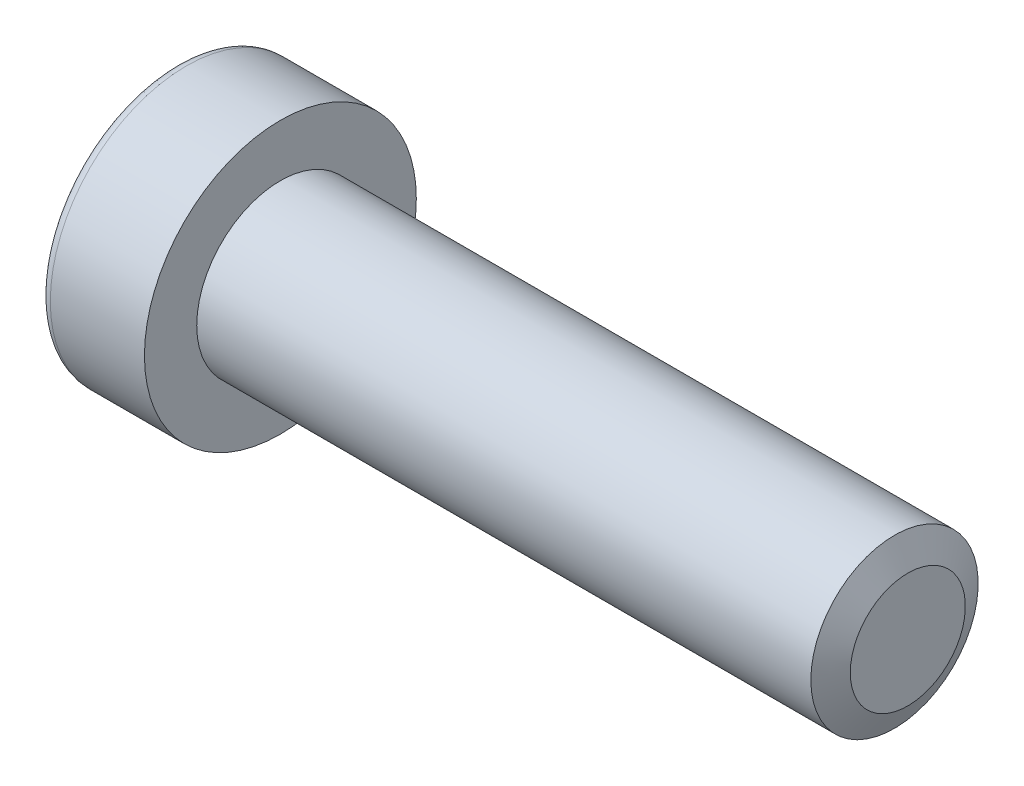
SolidWorks part; units mm, degrees
ref_plane "Ebene vorne" through (0, 0, 0) normal (0, 0, 1) x (1, 0, 0)
ref_plane "Ebene oben" through (0, 0, 0) normal (0, 1, 0) x (1, 0, 0)
ref_plane "Ebene rechts" through (0, 0, 0) normal (1, 0, 0) x (0, 0, -1)
sketch "Skizze1" plane through (0, 0, 0) normal (0, 0, 1) x (1, 0, 0)
  line L0 (-65.0118, 0) -> (64.6036, 0) construction
  line L1 (-35, 0) -> (-35, 6.5)
  line L2 (-35, 6.5) -> (-30, 6.5)
  line L3 (-30, 6.5) -> (-30, 4)
  line L4 (-30, 4) -> (0, 4)
  line L5 (0, 4) -> (0, 0)
  line L6 (0, 0) -> (-35, 0)
  dimension "D1" = 8
  dimension "D2" = 30
  dimension "D3" = 13
  dimension "D4" = 5
revolve "Rotation1" add sketch "Skizze1" angle 360 about L0
fillet "Verrundung1" radius 0.5 1 edges at (-35, 0, 6.5)
sketch "Skizze2" plane through (-35, 0, 0) normal (-1, 0, 0) x (0, 0, 1)
  line L1 (2.5, 1.4434) -> (0, 2.8868)
  line L2 (0, 2.8868) -> (-2.5, 1.4434)
  line L3 (-2.5, 1.4434) -> (-2.5, -1.4434)
  line L4 (-2.5, -1.4434) -> (0, -2.8868)
  line L5 (0, -2.8868) -> (2.5, -1.4434)
  line L6 (2.5, -1.4434) -> (2.5, 1.4434)
  circle A0 centre (0, 0) radius 2.5 construction
  dimension "D1" = 5
extrude "Schnitt-Linear austragen1" cut sketch "Skizze2" against normal blind 3
chamfer "Fase1" distance 1.25 angle 27 1 edges at (0, 0, 4)
